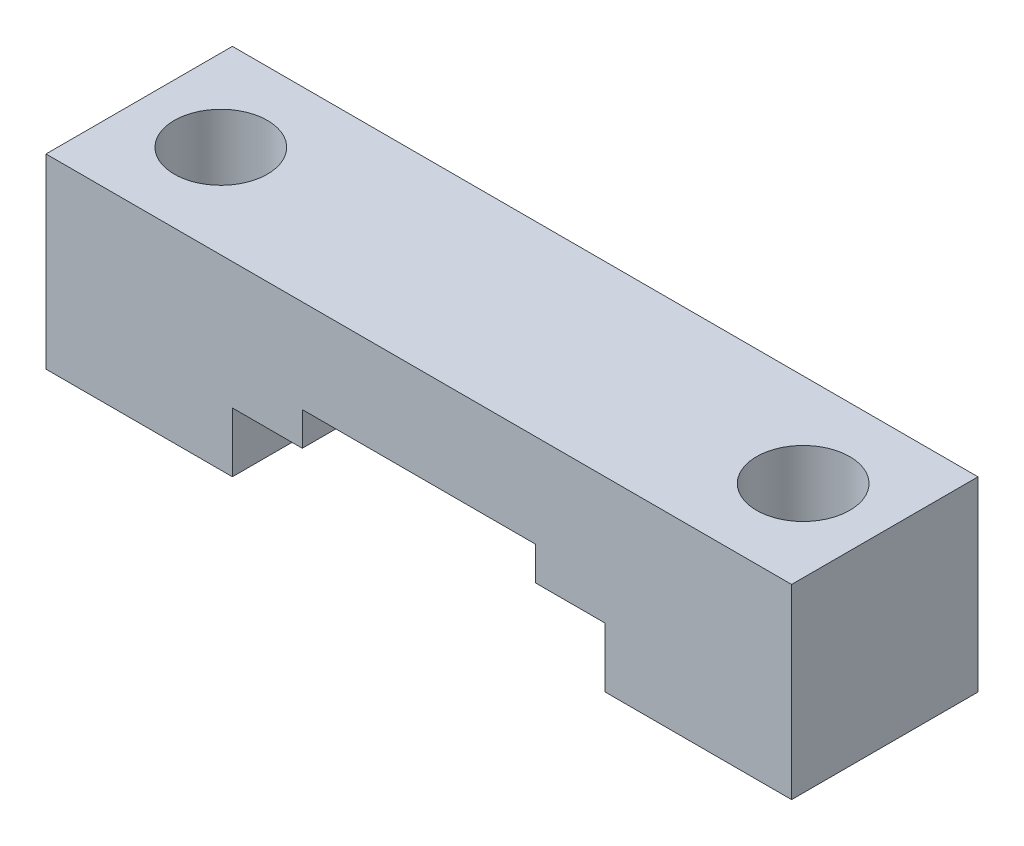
SolidWorks part; units mm, degrees
ref_plane "Front Plane" through (0, 0, 0) normal (0, 0, 1) x (1, 0, 0)
ref_plane "Top Plane" through (0, 0, 0) normal (0, 1, 0) x (1, 0, 0)
ref_plane "Right Plane" through (0, 0, 0) normal (1, 0, 0) x (0, 0, -1)
sketch "Sketch1" plane through (0, 0, 0) normal (0, 0, 1) x (1, 0, 0)
  line L0 (0, 0) -> (0, 9.6145) construction
  line L1 (12.7, 0) -> (12.7, 4.064)
  line L2 (7.9375, 6.35) -> (-7.9375, 6.35)
  line L3 (-12.7, 4.064) -> (-12.7, 0)
  line L4 (-12.7, 0) -> (-25.4, 0)
  line L5 (-25.4, 0) -> (-25.4, 12.7)
  line L6 (-25.4, 12.7) -> (25.4, 12.7)
  line L7 (25.4, 12.7) -> (25.4, 0)
  line L8 (25.4, 0) -> (12.7, 0)
  line L9 (-19.8374, 0) -> (-19.8374, 12.7)
  line L10 (19.8374, 0) -> (19.8374, 12.7)
  line L11 (-12.7, 4.064) -> (-7.9375, 4.064)
  line L12 (-7.9375, 4.064) -> (-7.9375, 6.35)
  line L13 (12.7, 4.064) -> (7.9375, 4.064)
  line L14 (7.9375, 4.064) -> (7.9375, 6.35)
  dimension "D1" = 25.4
  dimension "D2" = 50.8
  dimension "D3" = 6.35
  dimension "D4" = 6.35
  dimension "D5" = 5.5626
  dimension "D6" = 2.286
  dimension "D7" = 15.875
  dimension "D8" = 39.6748
  dimension "D9" = 12.7
sketch "Sketch2" plane through (0, 0, 0) normal (0, 0, 1) x (1, 0, 0)
  line L0 (-12.7, 0) -> (-25.4, 0) construction
  line L1 (-25.4, 0) -> (-25.4, 12.7) construction
  line L2 (-25.4, 12.7) -> (25.4, 12.7) construction
  line L3 (25.4, 12.7) -> (25.4, 0) construction
  line L4 (25.4, 0) -> (12.7, 0) construction
  line L8 (-12.7, 0) -> (-25.4, 0)
  line L9 (-25.4, 0) -> (-25.4, 12.7)
  line L10 (-25.4, 12.7) -> (25.4, 12.7)
  line L11 (25.4, 12.7) -> (25.4, 0)
  line L12 (25.4, 0) -> (12.7, 0)
  line L13 (-12.7, 4.064) -> (-12.7, 0) construction
  line L14 (-12.7, 4.064) -> (-7.9375, 4.064) construction
  line L15 (-7.9375, 4.064) -> (-7.9375, 6.35) construction
  line L16 (7.9375, 6.35) -> (-7.9375, 6.35) construction
  line L17 (7.9375, 4.064) -> (7.9375, 6.35) construction
  line L18 (12.7, 4.064) -> (7.9375, 4.064) construction
  line L19 (12.7, 0) -> (12.7, 4.064) construction
  line L20 (-12.7, 4.064) -> (-12.7, 0)
  line L21 (-12.7, 4.064) -> (-7.9375, 4.064)
  line L22 (-7.9375, 4.064) -> (-7.9375, 6.35)
  line L23 (7.9375, 6.35) -> (-7.9375, 6.35)
  line L24 (7.9375, 4.064) -> (7.9375, 6.35)
  line L25 (12.7, 4.064) -> (7.9375, 4.064)
  line L26 (12.7, 0) -> (12.7, 4.064)
extrude "Boss-Extrude1" add sketch "Sketch2" along normal mid plane 12.7
sketch "Sketch3" plane through (0, 0, 0) normal (0, 1, 0) x (1, 0, 0)
  circle A0 centre (-19.8374, 0) radius 3.175
  circle A1 centre (19.8374, 0) radius 3.175
  dimension "D1" = 6.35
extrude "Cut-Extrude1" cut sketch "Sketch3" along normal blind 25.4
